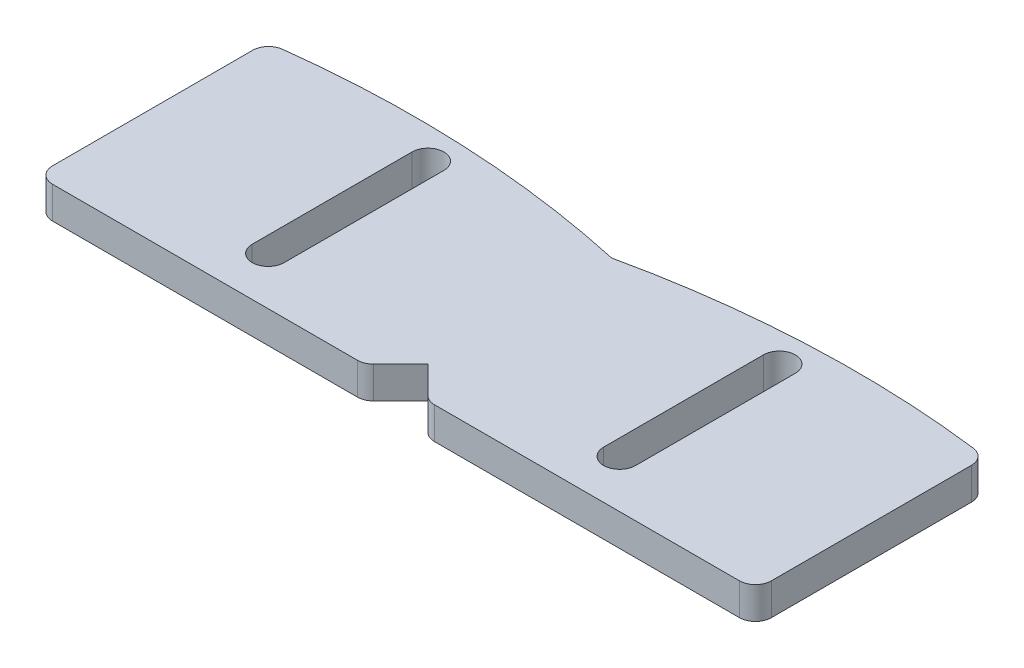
SolidWorks part; units mm, degrees
ref_plane "Plano frontal" through (0, 0, 0) normal (0, 0, 1) x (1, 0, 0)
ref_plane "Plano superior" through (0, 0, 0) normal (0, 1, 0) x (1, 0, 0)
ref_plane "Plano direito" through (0, 0, 0) normal (1, 0, 0) x (0, 0, -1)
sketch "Esboço1" plane through (0, 0, 0) normal (0, 1, 0) x (1, 0, 0)
  line L0 (-11, 5.5) -> (-11, -4.5) construction
  line L1 (-22.5, 7.5) -> (22.5, 7.5)
  line L2 (-22.5, 7.5) -> (-22.5, -7.5)
  line L3 (-22.5, -7.5) -> (22.5, -7.5)
  line L4 (22.5, 7.5) -> (22.5, -7.5)
  line L5 (-22.5, 7.5) -> (22.5, -7.5) construction
  line L6 (-22.5, -7.5) -> (22.5, 7.5) construction
  line L7 (-10, 5.5) -> (-10, -4.5)
  line L8 (-12, 5.5) -> (-12, -4.5)
  line L9 (0, -11.2226) -> (0, 11.3321) construction
  line L10 (0, -5.5) -> (-2, -7.5)
  line L11 (0, -5.5) -> (2, -7.5)
  line L12 (11, 5.5) -> (11, -4.5) construction
  line L13 (10, 5.5) -> (10, -4.5)
  line L14 (12, 5.5) -> (12, -4.5)
  arc A0 (-10, 5.5) -> (-12, 5.5) centre (-11, 5.5) ccw
  arc A1 (-12, -4.5) -> (-10, -4.5) centre (-11, -4.5) ccw
  arc A2 (0, 6) -> (-22.5, 6.9) centre (-13.764, -56.3988) ccw
  arc A3 (0, 6) -> (22.5, 6.9) centre (13.764, -56.3988) cw
  arc A4 (10, 5.5) -> (12, 5.5) centre (11, 5.5) cw
  arc A5 (12, -4.5) -> (10, -4.5) centre (11, -4.5) cw
  point P0 (0, 0)
  point P8 (-11, 0.5)
  point P25 (11, 0.5)
  dimension "D4" = 12
  dimension "D1" = 15
  dimension "D2" = 45
  dimension "D3" = 2
  dimension "D5" = 2
  dimension "D6" = 10
  dimension "D7" = 0.6
  dimension "D8" = 1.5
  dimension "D9" = 2
  dimension "D10" = 2
extrude "Ressalto-extrusão1" add sketch "Esboço1" along normal blind 2 contours A3 A2 L2 L3 L10 L11 L4 A1 L8 A0 L7 L14 A5 L13 A4
fillet "Filete1" radius 1 6 edges at (-22.5, 1, 7.5) (-2, 1, 7.5) (2, 1, 7.5) (22.5, 1, 7.5) (22.5, 1, -6.9) (-22.5, 1, -6.9)
